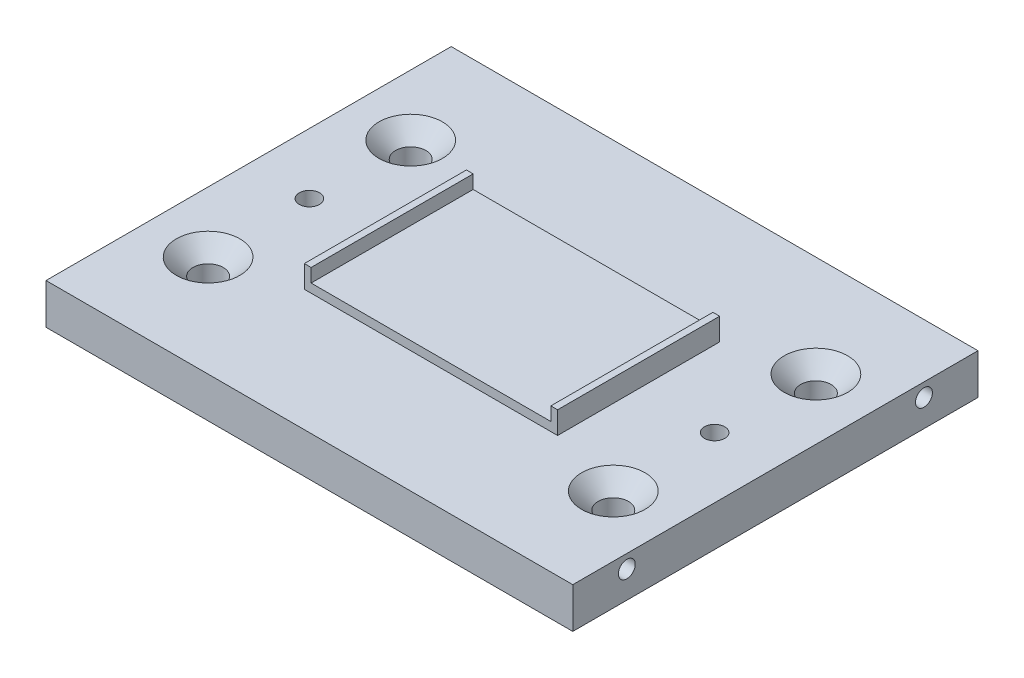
SolidWorks part; units mm, degrees
ref_plane "Front Plane" through (0, 0, 0) normal (0, 0, 1) x (1, 0, 0)
ref_plane "Top Plane" through (0, 0, 0) normal (0, 1, 0) x (1, 0, 0)
ref_plane "Right Plane" through (0, 0, 0) normal (1, 0, 0) x (0, 0, -1)
sketch "Sketch1" plane through (0, 0, 0) normal (1, 0, 0) x (0, 0, -1)
  line L1 (-30, -3) -> (30, -3)
  line L2 (-30, -3) -> (-30, 3)
  line L3 (-30, 3) -> (30, 3)
  line L4 (30, -3) -> (30, 3)
  line L5 (-30, -3) -> (30, 3) construction
  line L6 (-30, 3) -> (30, -3) construction
  point P0 (0, 0)
  dimension "D1" = 6
  dimension "D2" = 60
extrude "Boss-Extrude1" add sketch "Sketch1" along normal mid plane 78
sketch "Sketch2" plane through (0, 3, 0) normal (0, 1, 0) x (1, 0, 0)
  line L1 (-18.75, -12) -> (18.75, -12)
  line L2 (-18.75, -12) -> (-18.75, 12)
  line L3 (-18.75, 12) -> (18.75, 12)
  line L4 (18.75, -12) -> (18.75, 12)
  line L5 (-18.75, -12) -> (18.75, 12) construction
  line L6 (-18.75, 12) -> (18.75, -12) construction
  point P0 (0, 0)
  dimension "D1" = 24
  dimension "D2" = 37.5
extrude "Boss-Extrude2" add sketch "Sketch2" along normal blind 1.3
sketch "Sketch5" plane through (0, 4.3, 0) normal (0, 1, 0) x (1, 0, 0)
  line L0 (18.75, 12) -> (-18.75, 12) construction
  line L1 (-18.75, -12) -> (-17.75, -12)
  line L2 (-18.75, -12) -> (-18.75, 12)
  line L3 (-18.75, 12) -> (-17.75, 12)
  line L4 (-17.75, -12) -> (-17.75, 12)
  line L5 (18.75, 12) -> (-18.75, 12) construction
  line L6 (18.75, -12) -> (17.75, -12)
  line L7 (18.75, -12) -> (18.75, 12)
  line L8 (18.75, 12) -> (17.75, 12)
  line L9 (17.75, -12) -> (17.75, 12)
  dimension "D1" = 1
extrude "Boss-Extrude3" add sketch "Sketch5" along normal blind 2
hole_wizard "CSK for M4 Flat Head Machine Screw1" positions "Sketch7" profile "Sketch6" countersink size "M4" standard "ANSI Metric"
sketch "Sketch7" plane through (0, 3, 0) normal (0, 1, 0) x (1, 0, 0)
  point P0 (-30, 15)
  point P3 (30, 15)
  point P6 (30, -15)
  point P9 (-30, -15)
sketch "Sketch6" plane through (-30, 3, -15) normal (1, 0, 0) x (0, 0, 1)
  line L0 (0, 0) -> (0, 6)
  line L1 (0, 6) -> (2.25, 6)
  line L2 (2.25, 6) -> (2.25, 2.45)
  line L3 (2.25, 2.45) -> (4.7, 0)
  line L5 (4.7, 0) -> (0, 0)
  line L6 (-2.25, 2.45) -> (-4.7, 0) construction
  line L11 (0, -6.35) -> (0, 107.95) construction
  dimension "Thru Hole Dia." = 4.5
  dimension "Thru Hole Depth" = 6
  dimension "Near C'Sink Dia." = 9.4
  dimension "Near C'Sink Angle" = 90
hole_wizard "Ø3.0 (3) Diameter Hole2" positions "Sketch9" profile "Sketch8" hole size "Ø3.0" standard "ANSI Metric"
sketch "Sketch9" plane through (0, 3, 0) normal (0, 1, 0) x (1, 0, 0)
  point P0 (-30, 0)
  point P3 (30, 0)
sketch "Sketch8" plane through (-30, 3, 0) normal (1, 0, 0) x (0, 0, 1)
  line L0 (0, 0) -> (0, 6)
  line L1 (0, 6) -> (1.5, 6)
  line L2 (1.5, 6) -> (1.5, 0)
  line L5 (1.5, 0) -> (0, 0)
  line L11 (0, -6.35) -> (0, 107.95) construction
  dimension "Thru Hole Dia." = 3
  dimension "Thru Hole Depth" = 6
hole_wizard "M3x0.5 Tapped Hole1" positions "Sketch11" profile "Sketch10" tap size "M3x0.5" standard "ANSI Metric"
sketch "Sketch11" plane through (-39, 0, 0) normal (-1, 0, 0) x (0, 0, 1)
  line L0 (-30, 1) -> (-22, 1) construction
  line L1 (-30, -3) -> (-30, 3) construction
  line L2 (-22, 1) -> (22, 1) construction
  line L3 (22, 1) -> (30, 1) construction
  line L4 (30, 3) -> (30, -3) construction
  line L6 (30, -3) -> (-30, -3) construction
  point P0 (-22, 1)
  point P2 (22, 1)
  dimension "D1" = 8
  dimension "D2" = 4
sketch "Sketch10" plane through (-39, 1, -22) normal (0, 1, 0) x (0, 0, 1)
  line L0 (0, 0) -> (0, 8.2511)
  line L1 (0, 8.2511) -> (1.25, 7.5)
  line L2 (1.25, 7.5) -> (1.25, 0)
  line L5 (1.25, 0) -> (0, 0)
  line L10 (0, 8.2511) -> (-1.25, 7.5) construction
  line L11 (0, -6.35) -> (0, 107.95) construction
  dimension "Tap Drill Dia." = 2.5
  dimension "Tap Drill Depth" = 7.5
  dimension "Drill Angle" = 118
mirror "Mirror1" about plane through (0, 0, 0) normal (1, 0, 0) of "M3x0.5 Tapped Hole1"
